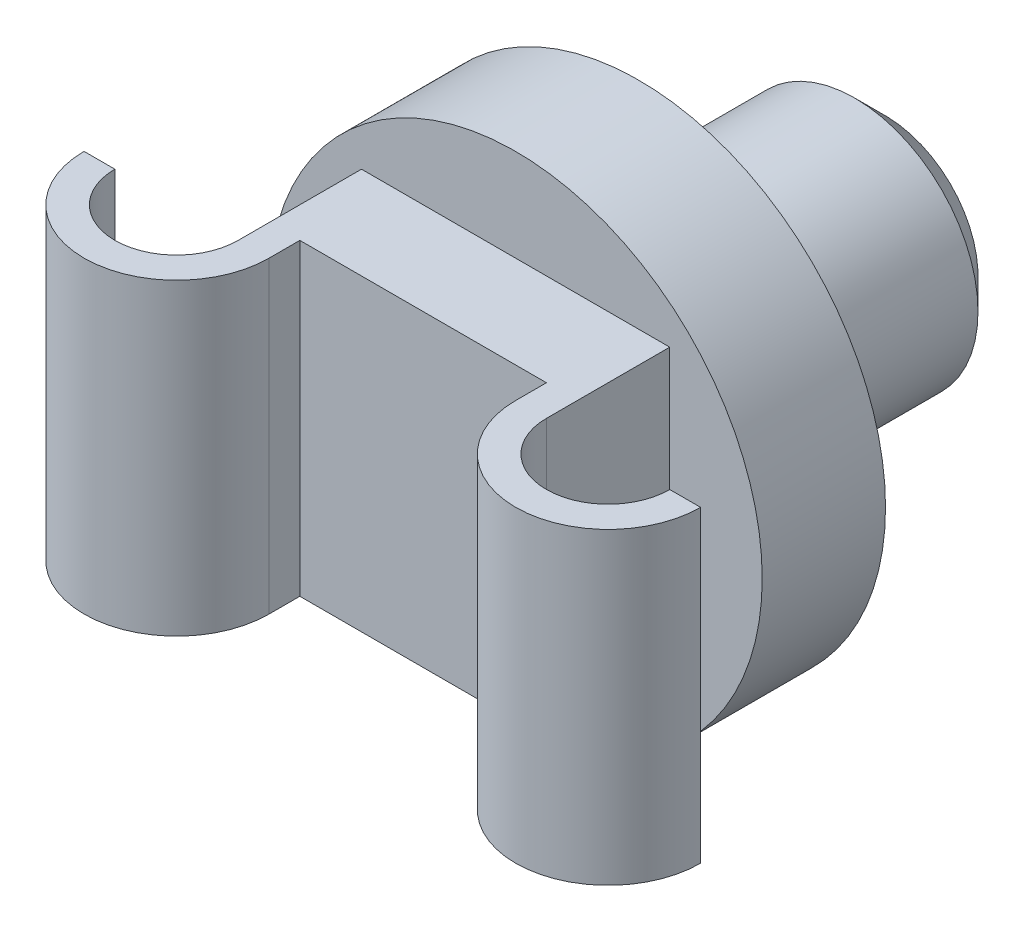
SolidWorks part; units mm, degrees
ref_plane "Plan de face" through (0, 0, 0) normal (0, 0, 1) x (1, 0, 0)
ref_plane "Plan de dessus" through (0, 0, 0) normal (0, 1, 0) x (1, 0, 0)
ref_plane "Plan de droite" through (0, 0, 0) normal (1, 0, 0) x (0, 0, -1)
sketch "Esquisse1" plane through (0, 0, 0) normal (0, 0, 1) x (1, 0, 0)
  circle A0 centre (0, 0) radius 4
  dimension "D1" = 8
extrude "Extrusion1" add sketch "Esquisse1" along normal blind 2
sketch "Esquisse2" plane through (0, 0, 2) normal (0, 0, 1) x (1, 0, 0)
  line L1 (-2.5, 2.5) -> (2.5, 2.5)
  line L2 (-2.5, 2.5) -> (-2.5, -2.5)
  line L3 (-2.5, -2.5) -> (2.5, -2.5)
  line L4 (2.5, 2.5) -> (2.5, -2.5)
  dimension "D1" = 5
  dimension "D2" = 5
  dimension "D3" = 2.5
  dimension "D4" = 2.5
extrude "Extrusion2" add sketch "Esquisse2" along normal blind 2
sketch "Esquisse5" plane through (0, -2.5, 0) normal (0, -1, 0) x (1, 0, 0)
  line L0 (-2.5, 4) -> (2.5, 4) construction
  line L1 (-2, 4.2) -> (2, 4.2)
  line L2 (-2, 4.2) -> (-2, 3.5)
  line L3 (-2, 3.5) -> (2, 3.5)
  line L4 (2, 4.2) -> (2, 3.5)
  dimension "D1" = 4
  dimension "D2" = 2
  dimension "D3" = 0.5
extrude "Enlèv. mat.-Extru.1" cut sketch "Esquisse5" against normal through all
sketch "Esquisse6" plane through (0, -2.5, 0) normal (0, -1, 0) x (1, 0, 0)
  line L0 (2, 4) -> (6.2858, 4) construction
  line L1 (2, 4) -> (2.5, 4)
  line L2 (4.5, 4) -> (5, 4)
  arc A0 (4.5, 4) -> (2.5, 4) centre (3.5, 4) ccw
  arc A1 (5, 4) -> (2, 4) centre (3.5, 4) ccw
  dimension "D1" = 3
extrude "Extrusion3" add sketch "Esquisse6" against normal blind 5
mirror "Symétrie1" about plane through (0, 0, 0) normal (1, 0, 0) of "Extrusion3"
sketch "Esquisse7" plane through (0, 0, 0) normal (0, 0, -1) x (-1, 0, 0)
  circle A0 centre (0, 0) radius 2
  dimension "D1" = 4
extrude "Extrusion4" add sketch "Esquisse7" along normal blind 4
chamfer "Chanfrein1" distance 0.5 angle 45 1 edges at (-2, 0, -4)
